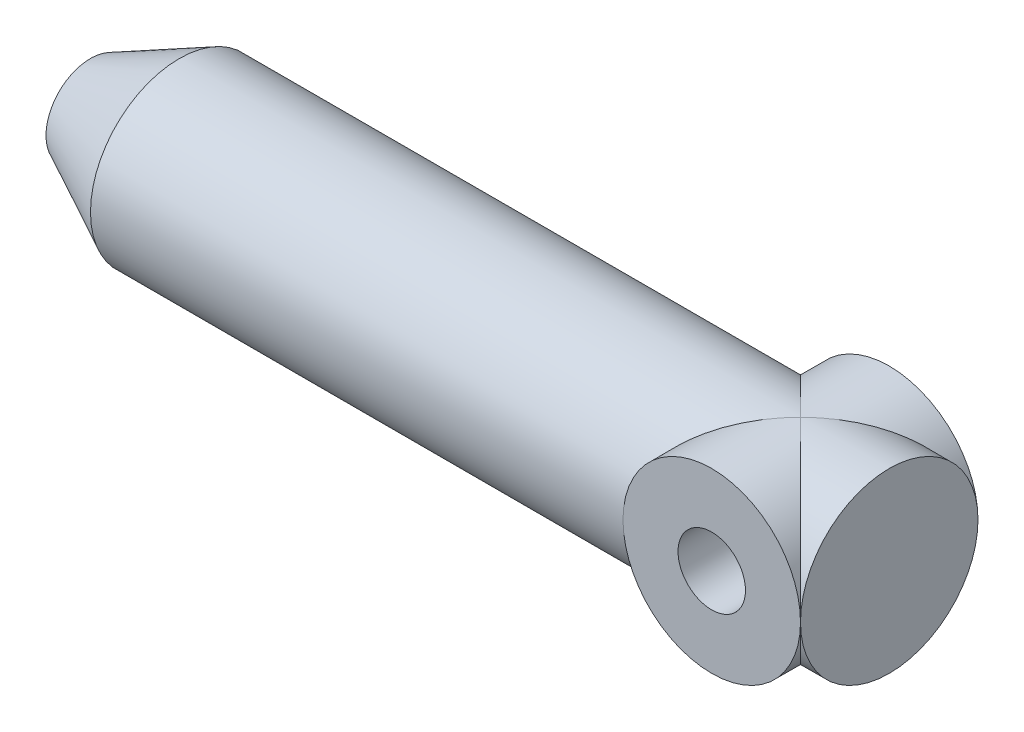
SolidWorks part; units mm, degrees
ref_plane "Front Plane" through (0, 0, 0) normal (0, 0, 1) x (1, 0, 0)
ref_plane "Top Plane" through (0, 0, 0) normal (0, 1, 0) x (1, 0, 0)
ref_plane "Right Plane" through (0, 0, 0) normal (1, 0, 0) x (0, 0, -1)
sketch "Sketch1" plane through (0, 0, 0) normal (0, 0, 1) x (1, 0, 0)
  line L0 (0, 0) -> (57.15, 0) construction
  line L1 (6.35, 6.35) -> (0, 3.1826)
  line L2 (6.35, 6.35) -> (57.15, 6.35)
  line L3 (57.15, 6.35) -> (57.15, 0)
  line L4 (57.15, 0) -> (0, 0)
  line L5 (0, 3.1826) -> (0, 0)
  dimension "D1" = 57.15
  dimension "D2" = 6.35
  dimension "D3" = 6.35
  dimension "D4" = 3.1826
revolve "Revolve1" add sketch "Sketch1" angle 360 about L0
sketch "Sketch2" plane through (0, 0, 0) normal (-1, 0, 0) x (0, 0, 1)
  circle A0 centre (0, 0) radius 3.175
  dimension "D1" = 6.35
extrude "Cut-Extrude1" cut sketch "Sketch2" against normal blind 44.45
sketch "Sketch3" plane through (0, 0, 0) normal (0, 0, 1) x (1, 0, 0)
  line L0 (57.15, -6.35) -> (57.15, 6.35) construction
  line L1 (6.35, -6.35) -> (57.15, -6.35) construction
  circle A0 centre (50.8, 0) radius 6.35
  dimension "D1" = 12.7
  dimension "D2" = 6.35
  dimension "D3" = 6.35
extrude "Boss-Extrude1" add sketch "Sketch3" along normal mid plane 12.7
sketch "Sketch4" plane through (0, 0, 6.35) normal (0, 0, 1) x (1, 0, 0)
  circle A0 centre (50.8, 0) radius 2.413
  dimension "D1" = 4.826
extrude "Cut-Extrude2" cut sketch "Sketch4" against normal through all
